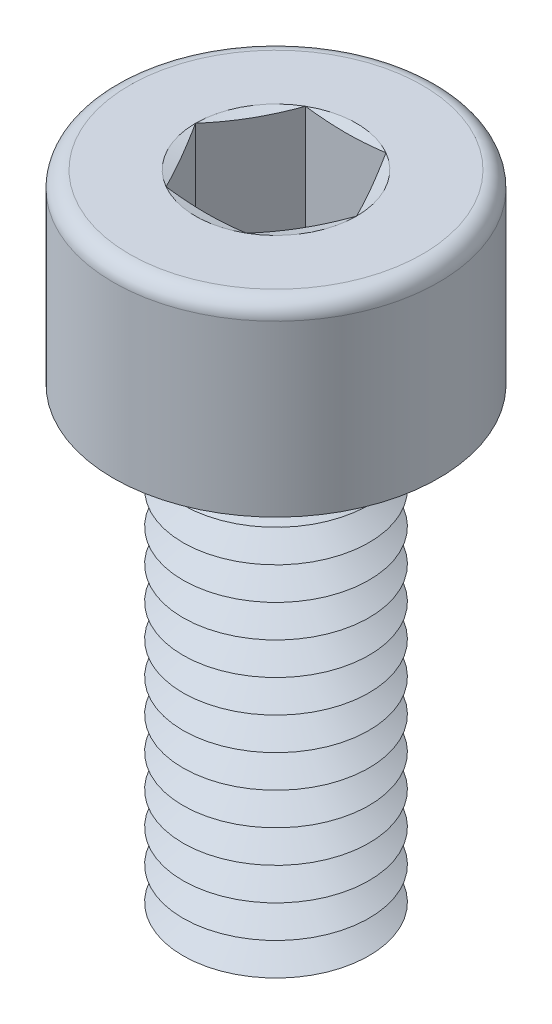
SolidWorks part; units mm, degrees
ref_plane "Front Plane" through (0, 0, 0) normal (0, 0, 1) x (1, 0, 0)
ref_plane "Top Plane" through (0, 0, 0) normal (0, 1, 0) x (1, 0, 0)
ref_plane "Right Plane" through (0, 0, 0) normal (1, 0, 0) x (0, 0, -1)
sketch "Sketch1" plane through (0, 0, 0) normal (0, 1, 0) x (1, 0, 0)
  circle A0 centre (0, 0) radius 2
  dimension "D1" = 4
extrude "Extrude1" add sketch "Sketch1" along normal blind 10
sketch "Sketch2" plane through (0, 10, 0) normal (0, 1, 0) x (1, 0, 0)
  circle A0 centre (0, 0) radius 3.5
  dimension "D1" = 7
extrude "Extrude2" add sketch "Sketch2" along normal blind 4
sketch "Sketch3" plane through (0, 14, 0) normal (0, 1, 0) x (1, 0, 0)
  line L1 (0.866, 1.5) -> (-0.866, 1.5)
  line L2 (-0.866, 1.5) -> (-1.7321, 0)
  line L3 (-1.7321, 0) -> (-0.866, -1.5)
  line L4 (-0.866, -1.5) -> (0.866, -1.5)
  line L5 (0.866, -1.5) -> (1.7321, 0)
  line L6 (1.7321, 0) -> (0.866, 1.5)
  circle A0 centre (0, 0) radius 1.5 construction
  dimension "D1" = 3
extrude "Extrude3" cut sketch "Sketch3" against normal blind 3
fillet "Fillet1" radius 0.35 1 edges at (0, 14, 3.5)
sketch "Sketch4" plane through (0, 0, 0) normal (1, 0, 0) x (0, 0, -1)
  line L0 (-1.5, 11) -> (0, 11)
  line L1 (0, 11) -> (0, 10.134)
  line L2 (0, 10.134) -> (-1.5, 11)
  dimension "D1" = 30
revolve "Cut-Revolve1" cut sketch "Sketch4" angle 360 about L1
sketch "Sketch5" plane through (0, 0, 0) normal (0, 0, 1) x (1, 0, 0)
  line L0 (-2, 0.35) -> (-2, -0.35)
  line L1 (-2, 10) -> (-2, 0) construction
  line L2 (-2, -0.35) -> (-1.3938, 0)
  line L3 (-2, 0) -> (2, 0) construction
  line L4 (-1.3938, 0) -> (-2, 0.35)
  dimension "D1" = 0.7
revolve "Cut-Revolve2" cut sketch "Sketch5" angle 360 about axis through (0, 10, 0) along (0, -1, 0)
pattern_linear "LPattern1" count 14 spacing 0.7 along (0, 1, 0) of "Cut-Revolve2"
sketch "Sketch6" plane through (0, 14, 0) normal (0, 1, 0) x (1, 0, 0)
  circle A0 centre (0, 0) radius 1.7321
extrude "Extrude4" cut sketch "Sketch6" against normal through all draft 75
